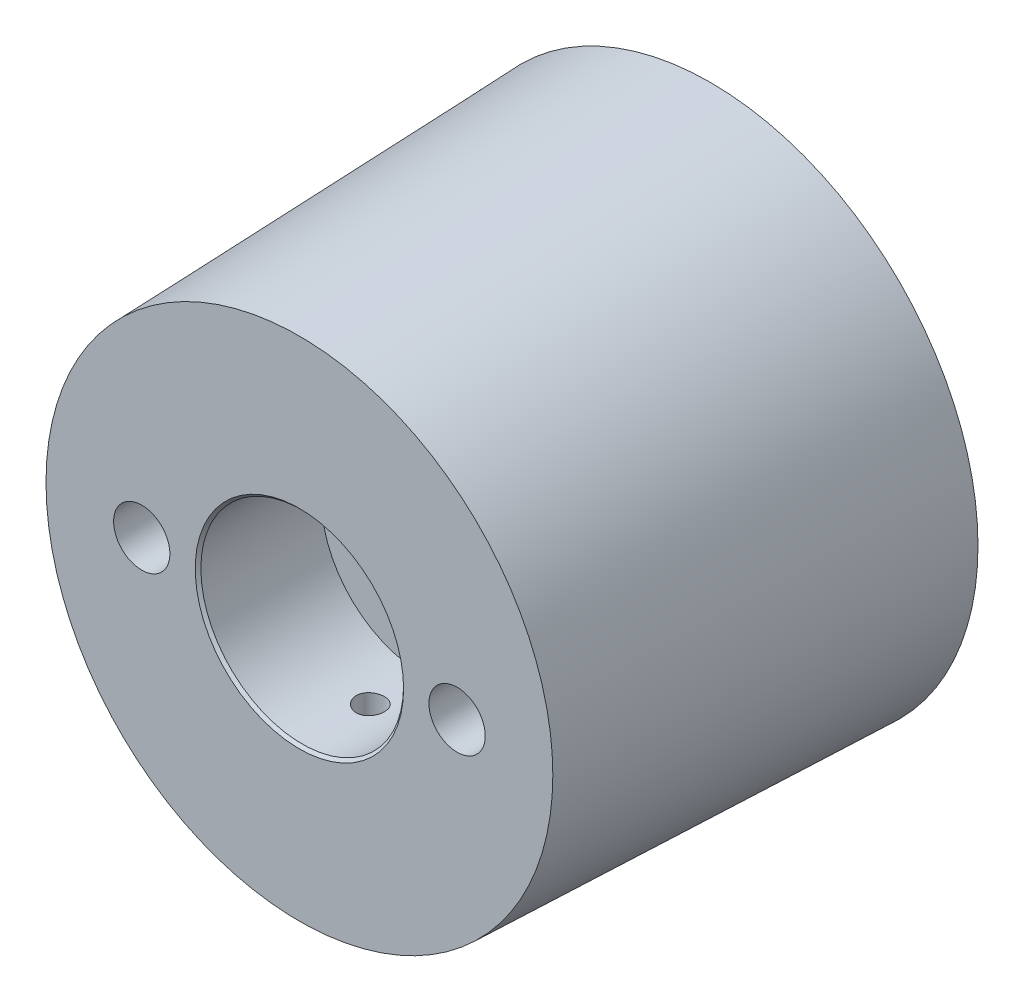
SolidWorks part; units mm, degrees
ref_plane "Front Plane" through (0, 0, 0) normal (0, 0, 1) x (1, 0, 0)
ref_plane "Top Plane" through (0, 0, 0) normal (0, 1, 0) x (1, 0, 0)
ref_plane "Right Plane" through (0, 0, 0) normal (1, 0, 0) x (0, 0, -1)
ref_plane "Plane1" through (0, 0, 70) normal (0, 0, 1) x (1, 0, 0)
ref_plane "Plane3" through (0, 0, -3) normal (0, 0, 1) x (1, 0, 0)
sketch "Sketch6" plane through (0, 0, -3) normal (0, 0, 1) x (1, 0, 0)
  circle A0 centre (0, 0) radius 47.5
  dimension "D1" = 95
sketch "Sketch2" plane through (0, 0, 70) normal (0, 0, 1) x (1, 0, 0)
  circle A0 centre (0, 0) radius 45
  dimension "D1" = 90
loft "Loft1" add profiles "Sketch2", "Sketch6"
sketch "Sketch7" plane through (0, 0, -3) normal (0, 0, -1) x (-1, 0, 0)
  circle A0 centre (0, 0) radius 35.05
  dimension "D1" = 70.1
extrude "Cut-Extrude2" cut sketch "Sketch7" against normal blind 43.7
sketch "Sketch8" plane through (0, 0, 70) normal (0, 0, 1) x (1, 0, 0)
  circle A0 centre (0, 0) radius 18
extrude "Cut-Extrude3" cut sketch "Sketch8" against normal blind 21.9
chamfer "Chamfer1" distance 0.5 angle 45 2 edges at (-35.05, 0, -3) (18, 0, 70)
hole_wizard "CBORE for M5 SHCS1" positions "Sketch10" profile "Sketch9" counterbore size "M5" standard "Ansi Metric"
sketch "Sketch10" plane through (0, 0, 70) normal (0, 0, 1) x (1, 0, 0)
  point P0 (-28, 0)
  point P3 (28, 0)
  dimension "D1" = 28
  dimension "D2" = 28
sketch "Sketch9" plane through (-28, 0, 70) normal (1, 0, 0) x (0, -1, 0)
  line L0 (0, 0) -> (0, 73.0001)
  line L1 (0, 73.0001) -> (2.65, 73.0001)
  line L3 (2.65, 73.0001) -> (2.65, 13)
  line L4 (2.65, 13) -> (5, 13)
  line L5 (5, 13) -> (5, 0)
  line L7 (5, 0) -> (0, 0)
  line L11 (0, -6.35) -> (0, 107.95) construction
  dimension "Thru Hole Dia." = 5.3
  dimension "Thru Hole Depth" = 73.0001
  dimension "C'Bore Dia." = 10
  dimension "C'Bore Depth" = 13
sketch "Sketch11" plane through (0, 0, 0) normal (0, 1, 0) x (1, 0, 0)
  line L0 (-45, -70) -> (45, -70) construction
  circle A0 centre (0, -57.4) radius 2.5
  dimension "D1" = 12.6
extrude "Cut-Extrude4" cut sketch "Sketch11" against normal up to next
sketch "Sketch12" plane through (0, 0, 48.1) normal (0, 0, 1) x (1, 0, 0)
  circle A0 centre (0, 0) radius 8
  dimension "D1" = 16
extrude "Cut-Extrude5" cut sketch "Sketch12" against normal up to next
sketch "Sketch13" plane through (0, 0, 40.7) normal (0, 0, -1) x (-1, 0, 0)
  circle A0 centre (0, 0) radius 14
extrude "Cut-Extrude6" cut sketch "Sketch13" against normal blind 4
